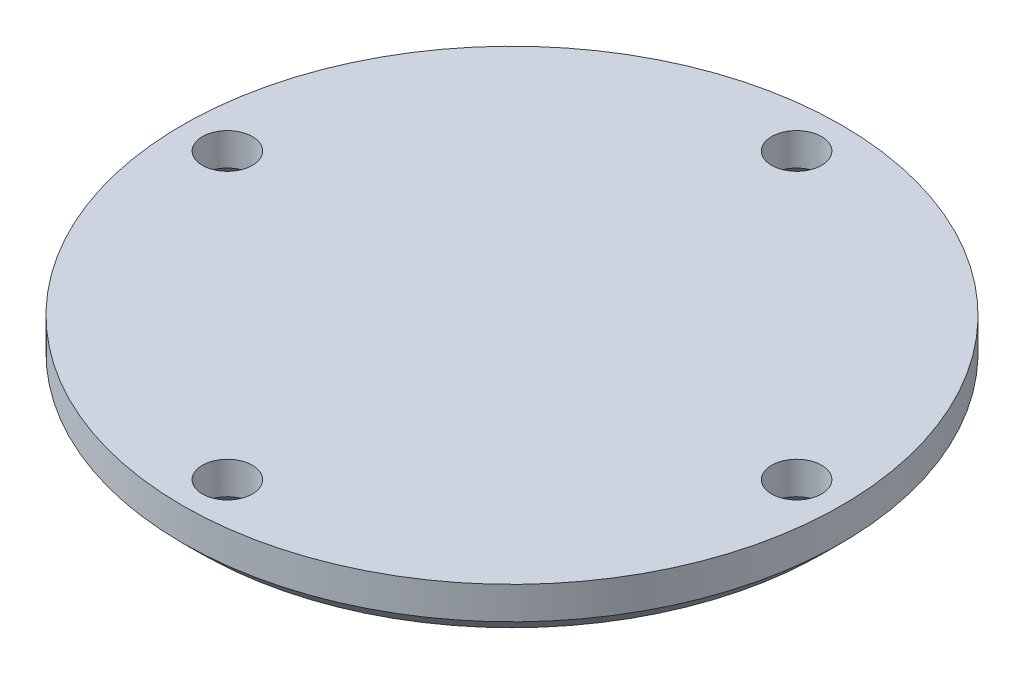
SolidWorks part; units mm, degrees
ref_plane "Front Plane" through (0, 0, 0) normal (0, 0, 1) x (1, 0, 0)
ref_plane "Top Plane" through (0, 0, 0) normal (0, 1, 0) x (1, 0, 0)
ref_plane "Right Plane" through (0, 0, 0) normal (1, 0, 0) x (0, 0, -1)
sketch "Sketch2" plane through (0, 0, 0) normal (0, 1, 0) x (1, 0, 0)
  circle A0 centre (0, 0) radius 33
  dimension "D1" = 66
extrude "Boss-Extrude1" add sketch "Sketch2" along normal blind 5
sketch "Sketch6" plane through (0, 5, 0) normal (0, 1, 0) x (1, 0, 0)
  circle A0 centre (0, 0) radius 26
sketch "Sketch7" plane through (0, 5, 0) normal (0, 1, 0) x (1, 0, 0)
  circle A8 centre (0, 0) radius 28.5 construction
  circle A17 centre (0, 28.5) radius 2.5
  circle A18 centre (28.5, 0) radius 2.5
  circle A19 centre (0, -28.5) radius 2.5
  circle A20 centre (-28.5, 0) radius 2.5
  dimension "D1" = 4
extrude "Cut-Extrude1" cut sketch "Sketch7" against normal through all
chamfer "Chamfer2" distance 1.75 angle 45 5 edges at (0, 0, 33) (-28.5, 0, 2.5) (0, 0, 31) (28.5, 0, 2.5) (0, 0, -26)
